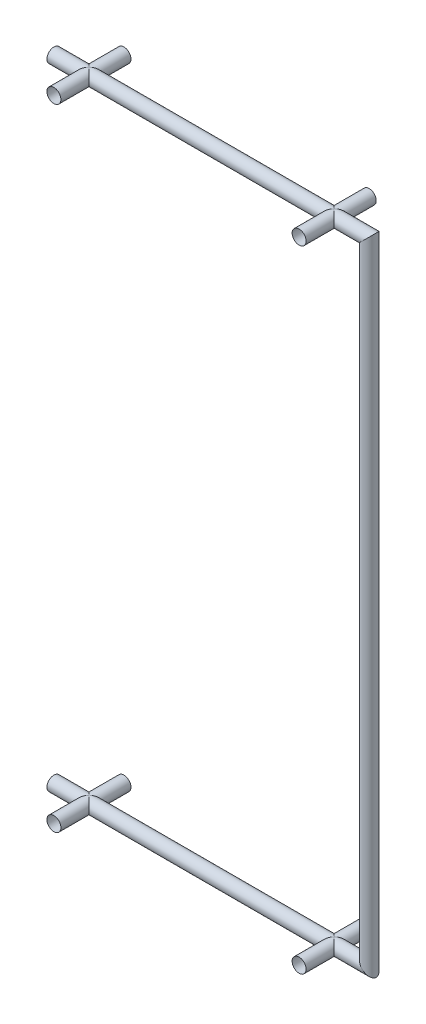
SolidWorks part; units mm, degrees
ref_plane "Plan de face" through (0, 0, 0) normal (0, 0, 1) x (1, 0, 0)
ref_plane "Plan de dessus" through (0, 0, 0) normal (0, 1, 0) x (1, 0, 0)
ref_plane "Plan de droite" through (0, 0, 0) normal (1, 0, 0) x (0, 0, -1)
sketch "Esquisse1" plane through (0, 0, 0) normal (0, 0, 1) x (1, 0, 0)
  line L0 (-90, 90) -> (0, 90)
  line L1 (0, 90) -> (0, -90)
  line L2 (0, -90) -> (-90, -90)
  dimension "D1" = 180
  dimension "D2" = 90
  dimension "D3" = 90
ref_plane "Plan1" through (-90, 0, 0) normal (1, 0, 0) x (0, 0, -1)
sketch "Esquisse2" plane through (-90, 0, 0) normal (1, 0, 0) x (0, 0, -1)
  circle A0 centre (0, 90) radius 2
  dimension "D1" = 4
surface "Surface-Balayage1"
sketch "Esquisse3" plane through (0, 0, 0) normal (0, 0, 1) x (1, 0, 0)
  circle A0 centre (-80, 90) radius 2
  circle A1 centre (-10, 90) radius 2
  circle A2 centre (-80, -90) radius 2
  circle A3 centre (-10, -90) radius 2
  dimension "D6" = 4
  dimension "D7" = 4
  dimension "D8" = 4
  dimension "D9" = 4
  dimension "D1" = 90
  dimension "D2" = 90
  dimension "D3" = 70
  dimension "D4" = 70
  dimension "D5" = 10
surface "Surface-Extrusion1" sketch "Esquisse3" parameters "D1"=20
ref_plane "Plan2" through (-45, 0, 0) normal (1, 0, 0) x (0, 0, -1)
